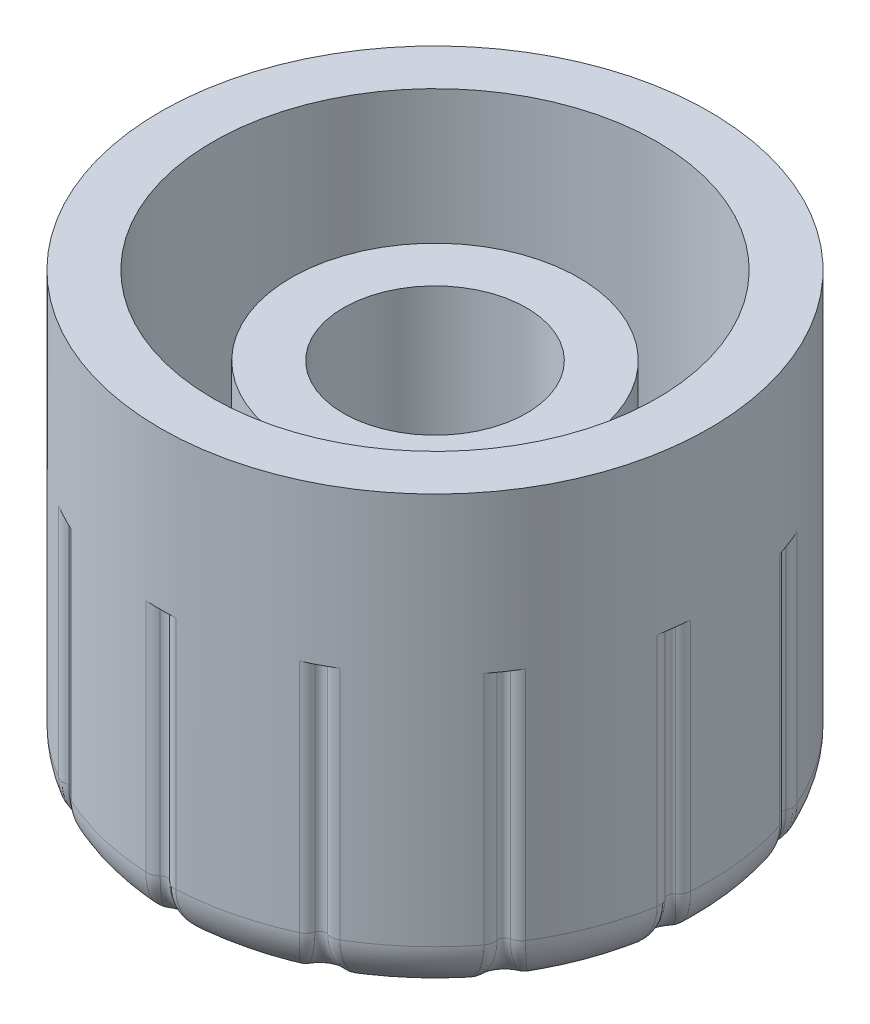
SolidWorks part; units mm, degrees
ref_plane "Front Plane" through (0, 0, 0) normal (0, 0, 1) x (1, 0, 0)
ref_plane "Top Plane" through (0, 0, 0) normal (0, 1, 0) x (1, 0, 0)
ref_plane "Right Plane" through (0, 0, 0) normal (1, 0, 0) x (0, 0, -1)
sketch "Sketch1" plane through (0, 0, 0) normal (0, 1, 0) x (1, 0, 0)
  circle A0 centre (0, 0) radius 10.5
  dimension "D1" = 21
extrude "Boss-Extrude1" add sketch "Sketch1" along normal blind 2
sketch "Sketch2" plane through (0, 0, 0) normal (0, 1, 0) x (1, 0, 0)
  circle A0 centre (0, 0) radius 8.5
  circle A1 centre (0, 0) radius 10.5
  dimension "D1" = 17
  dimension "D2" = 21
extrude "Boss-Extrude2" add sketch "Sketch2" along normal blind 17
sketch "Sketch3" plane through (0, 0, 0) normal (0, 1, 0) x (1, 0, 0)
  circle A0 centre (0, 0) radius 3.5
  circle A1 centre (0, 0) radius 5.5
  dimension "D1" = 7
  dimension "D2" = 11
extrude "Boss-Extrude3" add sketch "Sketch3" along normal blind 14
sketch "Sketch4" plane through (0, 0, 0) normal (0, 1, 0) x (1, 0, 0)
  line L0 (2.4495, 2.5) -> (2.4495, -2.5)
  circle A0 centre (0, 0) radius 3.5
  dimension "D1" = 7
  dimension "D2" = 5
extrude "Boss-Extrude4" add sketch "Sketch4" along normal blind 12 contours L0 A0
sketch "Sketch5" plane through (0, 0, 0) normal (0, -1, 0) x (1, 0, 0)
  line L0 (-0.003, 10.5) -> (4.8769, 9.2987) construction
  line L1 (4.8769, 9.2987) -> (8.6396, 5.9671) construction
  line L2 (8.6396, 5.9671) -> (10.4231, 1.2686) construction
  line L3 (10.4231, 1.2686) -> (9.8187, -3.7206) construction
  line L4 (9.8187, -3.7206) -> (6.965, -7.8574) construction
  line L5 (6.965, -7.8574) -> (2.5157, -10.1942) construction
  line L6 (2.5157, -10.1942) -> (-2.5099, -10.1956) construction
  line L7 (-2.5099, -10.1956) -> (-6.9605, -7.8613) construction
  line L8 (-6.9605, -7.8613) -> (-9.8166, -3.7261) construction
  line L9 (-9.8166, -3.7261) -> (-10.4238, 1.2627) construction
  line L10 (-10.4238, 1.2627) -> (-8.643, 5.9622) construction
  line L11 (-8.643, 5.9622) -> (-4.8822, 9.2959) construction
  line L12 (-4.8822, 9.2959) -> (-0.003, 10.5) construction
  circle A0 centre (-0.003, 10.5) radius 0.25
  circle A1 centre (0, 0) radius 10.5 construction
  circle A2 centre (4.8769, 9.2987) radius 0.25
  circle A3 centre (8.6396, 5.9671) radius 0.25
  circle A4 centre (10.4231, 1.2686) radius 0.25
  circle A5 centre (9.8187, -3.7206) radius 0.25
  circle A6 centre (6.965, -7.8574) radius 0.25
  circle A7 centre (2.5157, -10.1942) radius 0.25
  circle A8 centre (-2.5099, -10.1956) radius 0.25
  circle A9 centre (-6.9605, -7.8613) radius 0.25
  circle A10 centre (-9.8166, -3.7261) radius 0.25
  circle A11 centre (-10.4238, 1.2627) radius 0.25
  circle A12 centre (-8.643, 5.9622) radius 0.25
  circle A13 centre (-4.8822, 9.2959) radius 0.25
  dimension "D1" = 0.5
extrude "Cut-Extrude1" cut sketch "Sketch5" against normal blind 11
fillet "Fillet1" radius 2 26 edges at (4.7608, 0, 9.0773) (6.9605, 0, 7.8613) (8.4339, 0, 5.8251) (9.8166, 0, 3.7261) (10.1749, 0, 1.2384) (10.4238, 0, -1.2627) (9.585, 0, -3.632) (8.643, 0, -5.9622) (6.7992, 0, -7.6703) (4.8822, 0, -9.2959) (2.4558, 0, -9.9515) (0.003, 0, -10.5) (-2.4502, 0, -9.9529) (-4.8769, 0, -9.2987) (-6.7948, 0, -7.6742) (-8.6396, 0, -5.9671) (-9.5829, 0, -3.6374) (-10.4231, 0, -1.2686) (-10.1756, 0, 1.2326) (-9.8187, 0, 3.7206) (-8.4372, 0, 5.8203) (-6.965, 0, 7.8574) (-4.766, 0, 9.0746) (-2.5157, 0, 10.1942) (-0.0029, 0, 10.25) (2.5099, 0, 10.1956)
fillet "Fillet2" radius 0.5 52 edges at (-3.9569, 0.4357, 8.9068) (-5.0871, 0.4357, 8.3132) (-4.6595, 6.5, 9.4095) (-5.1022, 6.5, 9.177) (-7.6429, 0.4357, 6.0477) (-8.3677, 0.4357, 4.9969) (-9.5779, 0.4357, 1.8032) (-9.7314, 0.4357, 0.5358) (-9.3188, 0.4357, -2.8545) (-8.8658, 0.4357, -4.048) (-6.9249, 0.4357, -6.8582) (-5.9691, 0.4357, -7.7044) (-2.9445, 0.4357, -9.2907) (-1.7049, 0.4357, -9.5959) (1.7104, 0.4357, -9.5949) (2.9498, 0.4357, -9.2891) (5.9735, 0.4357, -7.701) (6.9288, 0.4357, -6.8542) (8.8681, 0.4357, -4.0429) (9.3204, 0.4357, -2.8491) (9.7311, 0.4357, 0.5414) (9.5769, 0.4357, 1.8086) (8.3649, 0.4357, 5.0016) (7.6394, 0.4357, 6.0521) (5.0824, 0.4357, 8.3161) (3.9518, 0.4357, 8.909) (0.6355, 0.4357, 9.7254) (-0.6411, 0.4357, 9.7251) (-8.4986, 6.5, 6.1663) (-8.7825, 6.5, 5.7548) (-10.3908, 6.5, 1.5105) (-10.4509, 6.5, 1.0141) (-9.9025, 6.5, -3.4914) (-9.7251, 6.5, -3.9588) (-7.1457, 6.5, -7.6934) (-6.7714, 6.5, -8.0248) (-2.7519, 6.5, -10.133) (-2.2665, 6.5, -10.2525) (2.2723, 6.5, -10.2512) (2.7577, 6.5, -10.1314) (6.776, 6.5, -8.021) (7.1501, 6.5, -7.6893) (9.7274, 6.5, -3.9533) (9.9045, 6.5, -3.4857) (10.4503, 6.5, 1.0201) (10.3899, 6.5, 1.5164) (8.7792, 6.5, 5.7598) (8.4951, 6.5, 6.1711) (5.0969, 6.5, 9.1799) (4.6542, 6.5, 9.4122) (0.247, 6.5, 10.4971) (-0.253, 6.5, 10.497)
fillet "Fillet3" radius 2 1 edges at (0, 2, 8.5)
fillet "Fillet4" radius 1 1 edges at (0, 2, 5.5)
